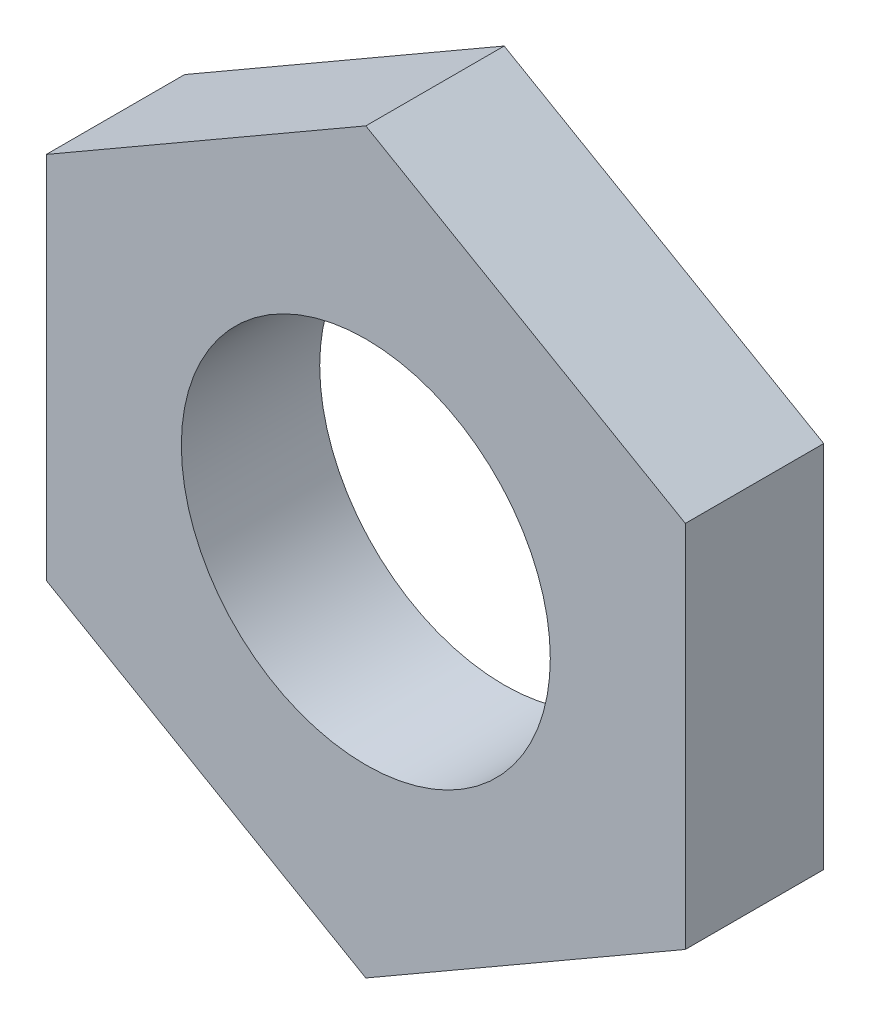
SolidWorks part; units mm, degrees
ref_plane "Front Plane" through (0, 0, 0) normal (0, 0, 1) x (1, 0, 0)
ref_plane "Top Plane" through (0, 0, 0) normal (0, 1, 0) x (1, 0, 0)
ref_plane "Right Plane" through (0, 0, 0) normal (1, 0, 0) x (0, 0, -1)
sketch "Sketch1" plane through (0, 0, 0) normal (0, 0, 1) x (1, 0, 0)
  line L1 (-34.641, 20) -> (-34.641, -20)
  line L2 (-34.641, -20) -> (0, -40)
  line L3 (0, -40) -> (34.641, -20)
  line L4 (34.641, -20) -> (34.641, 20)
  line L5 (34.641, 20) -> (0, 40)
  line L6 (0, 40) -> (-34.641, 20)
  circle A0 centre (0, 0) radius 20
  circle A1 centre (0, 0) radius 34.641 construction
  point P3 (0, 0)
  point P11 (-34.641, 0)
  dimension "D1" = 40
  dimension "D2" = 40
extrude "Boss-Extrude1" add sketch "Sketch1" along normal mid plane 15
